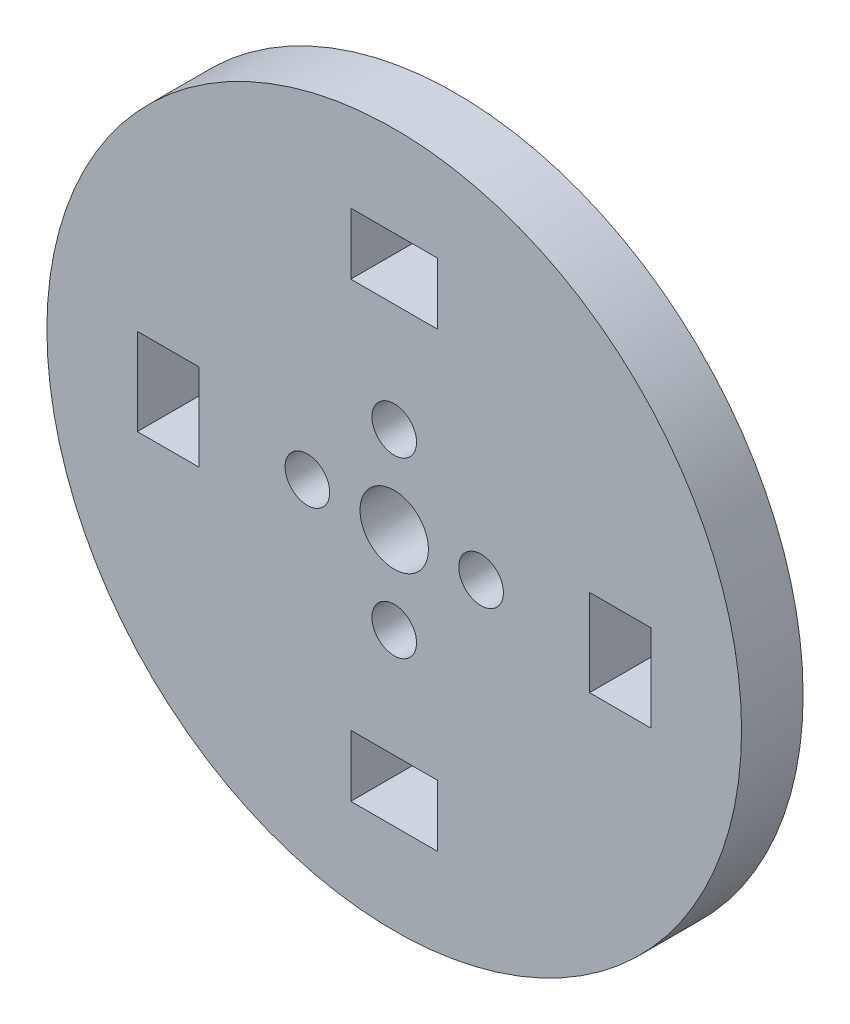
SolidWorks part; units mm, degrees
ref_plane "Front Plane" through (0, 0, 0) normal (0, 0, 1) x (1, 0, 0)
ref_plane "Top Plane" through (0, 0, 0) normal (0, 1, 0) x (1, 0, 0)
ref_plane "Right Plane" through (0, 0, 0) normal (1, 0, 0) x (0, 0, -1)
sketch "Sketch1" plane through (0, 0, 0) normal (0, 0, 1) x (1, 0, 0)
  circle A0 centre (0, 0) radius 2.5
  circle A1 centre (0, 0) radius 25.4
  dimension "D1" = 5
  dimension "D2" = 50.8
extrude "Boss-Extrude1" add sketch "Sketch1" along normal blind 4.5
sketch "Sketch2" plane through (0, 0, 4.5) normal (0, 0, 1) x (1, 0, 0)
  line L0 (0, 18.7836) -> (0, 14.2836) construction
  line L1 (-3.175, 18.7836) -> (3.175, 18.7836)
  line L2 (-3.175, 18.7836) -> (-3.175, 14.2836)
  line L3 (-3.175, 14.2836) -> (3.175, 14.2836)
  line L4 (3.175, 18.7836) -> (3.175, 14.2836)
  line L5 (14.2836, 3.175) -> (14.2836, -3.175)
  line L6 (18.7836, 3.175) -> (14.2836, 3.175)
  line L7 (18.7836, 3.175) -> (18.7836, -3.175)
  line L8 (18.7836, -3.175) -> (14.2836, -3.175)
  line L9 (3.175, -14.2836) -> (-3.175, -14.2836)
  line L10 (3.175, -18.7836) -> (3.175, -14.2836)
  line L11 (3.175, -18.7836) -> (-3.175, -18.7836)
  line L12 (-3.175, -18.7836) -> (-3.175, -14.2836)
  line L13 (-14.2836, -3.175) -> (-14.2836, 3.175)
  line L14 (-18.7836, -3.175) -> (-14.2836, -3.175)
  line L15 (-18.7836, -3.175) -> (-18.7836, 3.175)
  line L16 (-18.7836, 3.175) -> (-14.2836, 3.175)
  circle A0 centre (0, 0) radius 19.05
  circle A1 centre (0, 0) radius 17.4625
  point P26 (0, 0)
  dimension "D1" = 38.1
  dimension "D3" = 4.5
  dimension "D4" = 6.35
  dimension "D5" = 0
  dimension "D2" = 1.5875
  dimension "D6" = 4
extrude "Cut-Extrude1" cut sketch "Sketch2" against normal through all contours L16 A1 L14 L13 | A1 L16 L15 L14 | L1 L0 A1 L4 | L0 L1 L2 A1 | L0 A1 L2 L3 | A1 L0 L3 L4 | L8 A1 L6 L5 | A1 L8 L7 L6 | L12 A1 L10 L9 | A1 L12 L11 L10
sketch "Sketch3" plane through (0, 0, 4.5) normal (0, 0, 1) x (1, 0, 0)
  point P0 (0, 6.35)
  point P5 (6.35, 0)
  point P6 (0, -6.35)
  point P7 (-6.35, 0)
  point P8 (0, 0)
  dimension "D1" = 6.35
  dimension "D2" = 4
hole_wizard "#4 Clearance Hole1" positions "Sketch5" profile "Sketch4" hole size "#4" standard "ANSI Inch"
sketch "Sketch5" plane through (0, 0, 4.5) normal (0, 0, 1) x (1, 0, 0)
  point P0 (0, 6.35)
  point P3 (6.35, 0)
  point P6 (0, -6.35)
  point P9 (-6.35, 0)
sketch "Sketch4" plane through (0, 6.35, 4.5) normal (1, 0, 0) x (0, -1, 0)
  line L0 (0, 0) -> (0, 26.3806)
  line L1 (0, 26.3806) -> (1.6319, 25.4)
  line L2 (1.6319, 25.4) -> (1.6319, 0)
  line L5 (1.6319, 0) -> (0, 0)
  line L10 (0, 26.3806) -> (-1.632, 25.4) construction
  line L11 (0, -6.35) -> (0, 107.95) construction
  dimension "Hole Dia." = 3.2639
  dimension "Hole Depth" = 25.4
  dimension "Drill Angle" = 118
